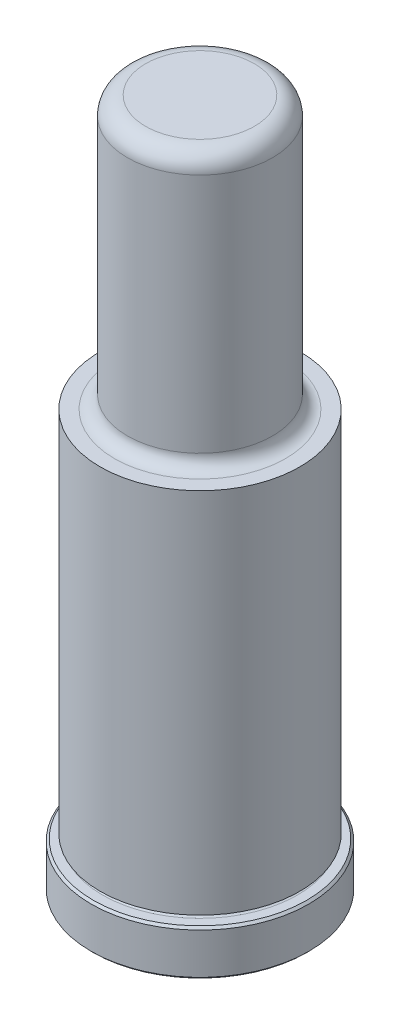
SolidWorks part; units mm, degrees
ref_plane "Front Plane" through (0, 0, 0) normal (0, 0, 1) x (1, 0, 0)
ref_plane "Top Plane" through (0, 0, 0) normal (0, 1, 0) x (1, 0, 0)
ref_plane "Right Plane" through (0, 0, 0) normal (1, 0, 0) x (0, 0, -1)
sketch "Sketch1" plane through (0, 0, 0) normal (1, 0, 0) x (0, 0, -1)
  line L0 (0, 0) -> (19.05, 0)
  line L1 (19.05, 0) -> (19.05, 7.9248)
  line L2 (19.05, 7.9248) -> (17.0688, 7.9248)
  line L3 (16.6878, 2.6782) -> (16.6878, 5.9795) construction
  line L4 (17.0688, 8.6868) -> (17.4752, 8.6868)
  line L5 (17.4752, 8.6868) -> (17.4752, 73.025)
  line L6 (17.4752, 73.025) -> (14.9733, 73.025)
  line L7 (12.6873, 75.311) -> (12.6873, 120.65)
  line L9 (12.6873, 120.65) -> (0, 120.65)
  line L10 (0, 120.65) -> (0, 0)
  line L11 (0, 0) -> (0, -7.2694) construction
  arc A0 (17.0688, 8.6868) -> (17.0688, 7.9248) centre (17.0688, 8.3058) ccw
  arc A1 (14.9733, 73.025) -> (12.6873, 75.311) centre (14.9733, 75.311) cw
  point P2 (12.6873, 120.65)
  point P14 (0, 0)
  point P19 (12.6873, 73.025)
  dimension "D14" = 0.762
  dimension "D8" = 2.286
  dimension "T" = 7.9248
  dimension "D2" = 0.762
  dimension "M" = 38.1
  dimension "B" = 34.9504
  dimension "L" = 120.65
  dimension "D7" = 0.7874
  dimension "A" = 73.025
  dimension "D" = 25.3746
  dimension "D15" = 47.625
revolve "Revolve1" add sketch "Sketch1" angle 360 about L11
chamfer "Chamfer1" distance 0.381 angle 45 2 edges at (0, 0, 19.05) (0, 7.9248, 19.05)
fillet "Fillet7" radius 3.175 1 edges at (0, 120.65, 12.6873)
